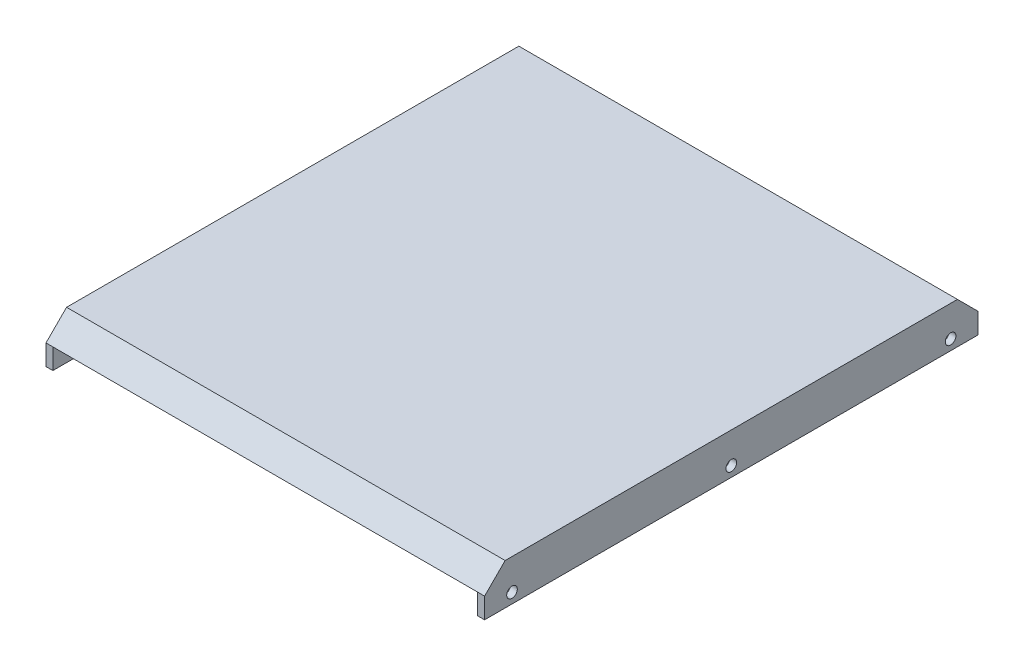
SolidWorks part; units mm, degrees
ref_plane "Front" through (0, 0, 0) normal (0, 0, 1) x (1, 0, 0)
ref_plane "Top" through (0, 0, 0) normal (0, 1, 0) x (1, 0, 0)
ref_plane "Right" through (0, 0, 0) normal (1, 0, 0) x (0, 0, -1)
sketch "Sketch1" plane through (0, 0, 0) normal (0, 0, 1) x (1, 0, 0)
  line L1 (-101.6, 9.525) -> (101.6, 9.525)
  line L2 (-101.6, 9.525) -> (-101.6, -9.525)
  line L3 (-101.6, -9.525) -> (101.6, -9.525)
  line L4 (101.6, 9.525) -> (101.6, -9.525)
  line L5 (0, -9.525) -> (0, 9.525) construction
  line L6 (-101.6, 0) -> (101.6, 0) construction
  point P0 (0, 0)
  dimension "D1" = 203.2
  dimension "D2" = 19.05
extrude "Boss-Extrude1" add sketch "Sketch1" along normal mid plane 228.6
sketch "Sketch2" plane through (0, 0, 114.3) normal (0, 0, 1) x (1, 0, 0)
  line L0 (-101.6, -9.525) -> (101.6, -9.525) construction
  line L1 (-98.425, -9.525) -> (98.425, -9.525)
  line L2 (-98.425, -9.525) -> (-98.425, 0)
  line L3 (-98.425, 0) -> (98.425, 0)
  line L4 (98.425, -9.525) -> (98.425, 0)
  point P6 (0, 0)
  dimension "D1" = 9.525
  dimension "D2" = 196.85
extrude "Cut-Extrude1" cut sketch "Sketch2" against normal through all
hole_wizard "#8 Clearance Hole1" positions "Sketch5" profile "Sketch4" hole size "#8" standard "ANSI Inch"
sketch "Sketch5" plane through (-101.6, 0, 0) normal (-1, 0, 0) x (0, 0, 1)
  line L0 (-101.6, 0) -> (-101.6, -9.525) construction
  line L1 (-114.3, 0) -> (114.3, 0) construction
  line L2 (114.3, -9.525) -> (-114.3, -9.525) construction
  line L4 (0, 9.525) -> (0, -9.525) construction
  line L5 (114.3, 9.525) -> (-114.3, 9.525) construction
  point P0 (-101.6, -4.7625)
  point P17 (0, -4.7625)
  point P19 (101.6, -4.7625)
  dimension "D1" = 203.2
sketch "Sketch4" plane through (-101.6, -4.7625, -101.6) normal (0, 1, 0) x (0, 0, 1)
  line L0 (0, 0) -> (0, 203.2)
  line L1 (0, 203.2) -> (2.4574, 203.2)
  line L2 (2.4574, 203.2) -> (2.4574, 0)
  line L5 (2.4574, 0) -> (0, 0)
  line L11 (0, -6.35) -> (0, 107.95) construction
  dimension "Thru Hole Dia." = 4.9149
  dimension "Thru Hole Depth" = 203.2
chamfer "Chamfer1" distance 9.525 angle 45 2 edges at (0, 9.525, 114.3) (0, 9.525, -114.3)
